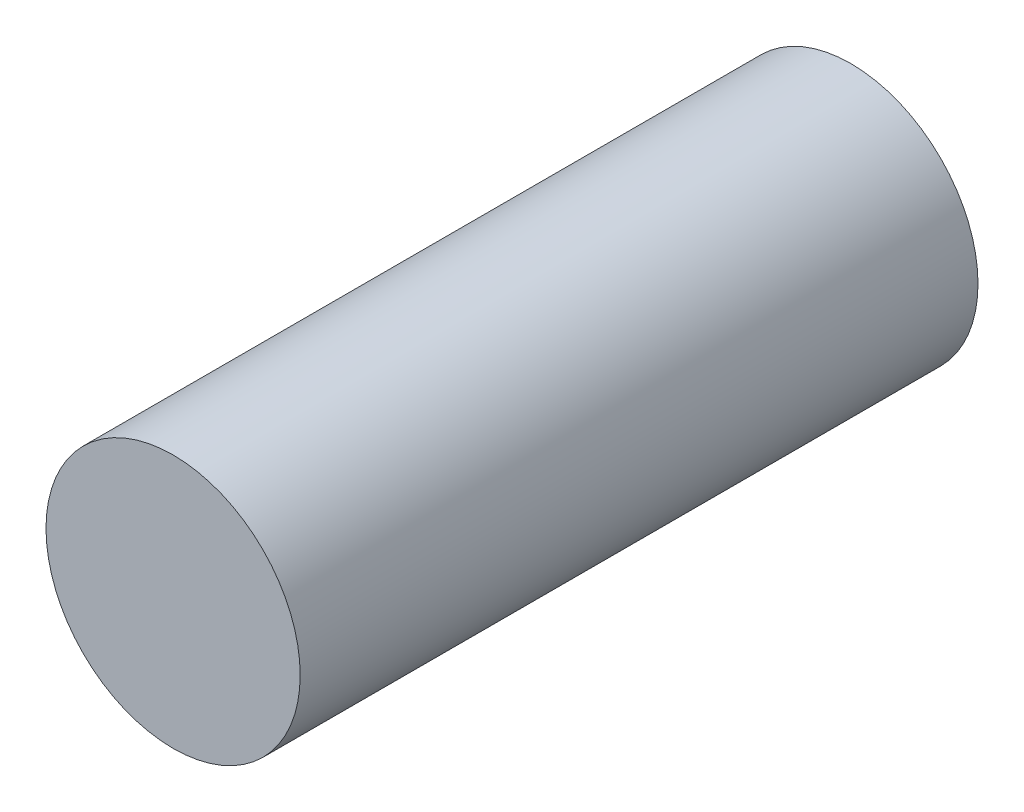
SolidWorks part; units mm, degrees
ref_plane "Plan de face" through (0, 0, 0) normal (0, 0, 1) x (1, 0, 0)
ref_plane "Plan de dessus" through (0, 0, 0) normal (0, 1, 0) x (1, 0, 0)
ref_plane "Plan de droite" through (0, 0, 0) normal (1, 0, 0) x (0, 0, -1)
sketch "Esquisse1" plane through (0, 0, 0) normal (0, 0, 1) x (1, 0, 0)
  circle A0 centre (0, 0) radius 7.5
  dimension "D1" = 15
extrude "Boss.-Extru.1" add sketch "Esquisse1" along normal blind 40
